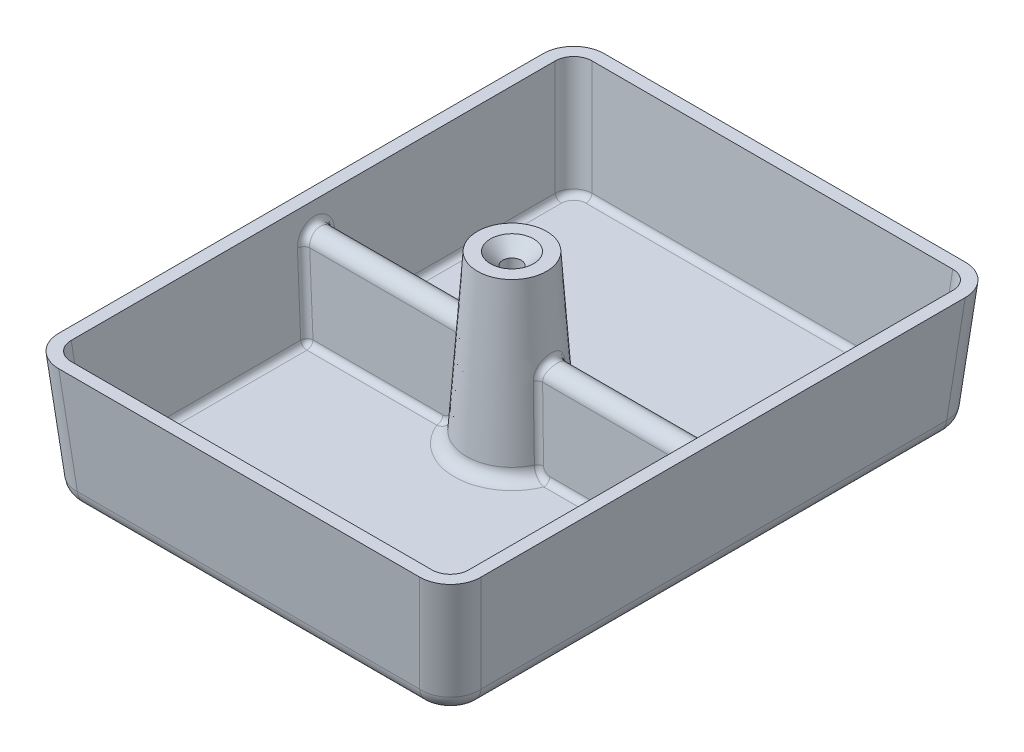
SolidWorks part; units mm, degrees
ref_plane "Front" through (0, 0, 0) normal (0, 0, 1) x (1, 0, 0)
ref_plane "Top" through (0, 0, 0) normal (0, 1, 0) x (1, 0, 0)
ref_plane "Right" through (0, 0, 0) normal (1, 0, 0) x (0, 0, -1)
sketch "Sketch1" plane through (0, 0, 0) normal (0, 1, 0) x (1, 0, 0)
  line L0 (-32.5, -42.5) -> (32.5, -42.5)
  line L1 (-32.5, -42.5) -> (-32.5, 42.5)
  line L2 (32.5, 42.5) -> (-32.5, 42.5)
  line L3 (32.5, 42.5) -> (32.5, -42.5)
  line L4 (-32.5, 42.5) -> (32.5, -42.5) construction
  point P5 (0, 0)
  dimension "D1" = 85
  dimension "D2" = 65
extrude "Base-Extrude" add sketch "Sketch1" along normal blind 20 draft 5
fillet "Fillet1" radius 5 4 edges at (-33.3749, 10, 43.3749) (33.3749, 10, 43.3749) (33.3749, 10, -43.3749) (-33.3749, 10, -43.3749)
fillet "Fillet2" radius 3 8 edges at (-32.5, 0, 0) (0, 0, -42.5) (32.5, 0, 0) (0, 0, 42.5) (31.0434, 0, -41.0434) (31.0434, 0, 41.0434) (-31.0434, 0, 41.0434) (-31.0434, 0, -41.0434)
shell "Shell1" thickness 2
sketch "Sketch2" plane through (0, 0, 0) normal (1, 0, 0) x (0, 0, -1)
  line L0 (0, 0) -> (0, 23.9525) construction
  line L1 (-2.5695, 2) -> (-1.9981, 15.0872)
  line L2 (37.7586, 2) -> (-37.7586, 2) construction
  line L3 (1.9981, 15.0872) -> (2.5695, 2)
  line L4 (2.5695, 2) -> (-2.5695, 2)
  arc A0 (-1.9981, 15.0872) -> (1.9981, 15.0872) centre (0, 15) cw
  dimension "D1" = 2
  dimension "D2" = 15
  dimension "D3" = 5
extrude "Rib" add sketch "Sketch2" along normal up to next and the other way up to next
sketch "Sketch3" plane through (0, 2, 0) normal (0, 1, 0) x (-1, 0, 0)
  circle A0 centre (0, 0) radius 7.5
  dimension "D1" = 15
extrude "CylBoss" add sketch "Sketch3" along normal blind 27 draft 4
fillet "Fillet4" radius 2 4 edges at (0, 2, 7.5) (0, 2, -7.5)
fillet "Fillet5" radius 1 24 edges at (31.9797, 17, 0) (31.2798, 9, -2.2639) (30.4266, 2.2627, -2.558) (19.3783, 2, -2.5695) (19.3783, 2, 2.5695) (-30.4266, 2.2627, 2.558) (-30.4266, 2.2627, -2.558) (-31.2798, 9, 2.2639) (-31.9797, 17, 0) (-31.2798, 9, -2.2639) (-6.4471, 16.9831, -0.2592) (6.4471, 16.9831, 0.2592) (-19.3783, 2, -2.5695) (-7.4251, 2.6975, -2.539) (7.6635, 2.4706, -2.549) (7.4251, 2.6975, 2.539) (-19.3783, 2, 2.5695) (-7.6635, 2.4706, 2.549) (30.4266, 2.2627, 2.558) (31.2798, 9, 2.2639)
hole_wizard "CounterSnk" positions "Sketch4" profile "Sketch5" legacy
sketch "Sketch4" plane through (0, 29, 0) normal (0, 1, 0) x (-1, 0, 0)
  point P0 (0, 0)
sketch "Sketch5" plane through (0, 29, 0) normal (1, 0, 0) x (0, 0, 1)
  line L0 (0, 0) -> (0, 29)
  line L1 (0, 29) -> (1.5, 29)
  line L2 (1.5, 29) -> (1.5, 2)
  line L3 (1.5, 2) -> (3.5, 0)
  line L4 (3.5, 0) -> (0, 0)
  line L5 (0, 116.4889) -> (0, 0) construction
